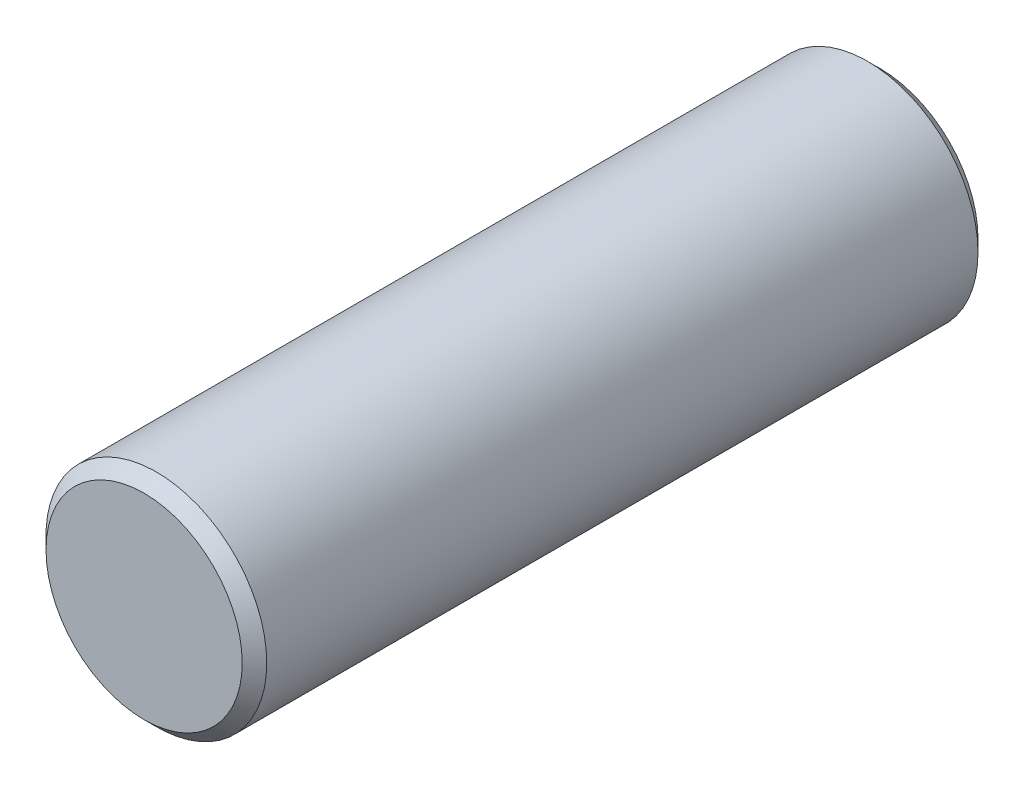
SolidWorks part; units mm, degrees
ref_plane "Plan de face" through (0, 0, 0) normal (0, 0, 1) x (1, 0, 0)
ref_plane "Plan de dessus" through (0, 0, 0) normal (0, 1, 0) x (1, 0, 0)
ref_plane "Plan de droite" through (0, 0, 0) normal (1, 0, 0) x (0, 0, -1)
sketch "Esquisse1" plane through (0, 0, 0) normal (0, 0, 1) x (1, 0, 0)
  circle A0 centre (0, 0) radius 9
  dimension "D1" = 18
extrude "Boss.-Extru.1" add sketch "Esquisse1" along normal blind 60
chamfer "Chanfrein1" distance 1 angle 45 2 edges at (9, 0, 0) (9, 0, 60)
